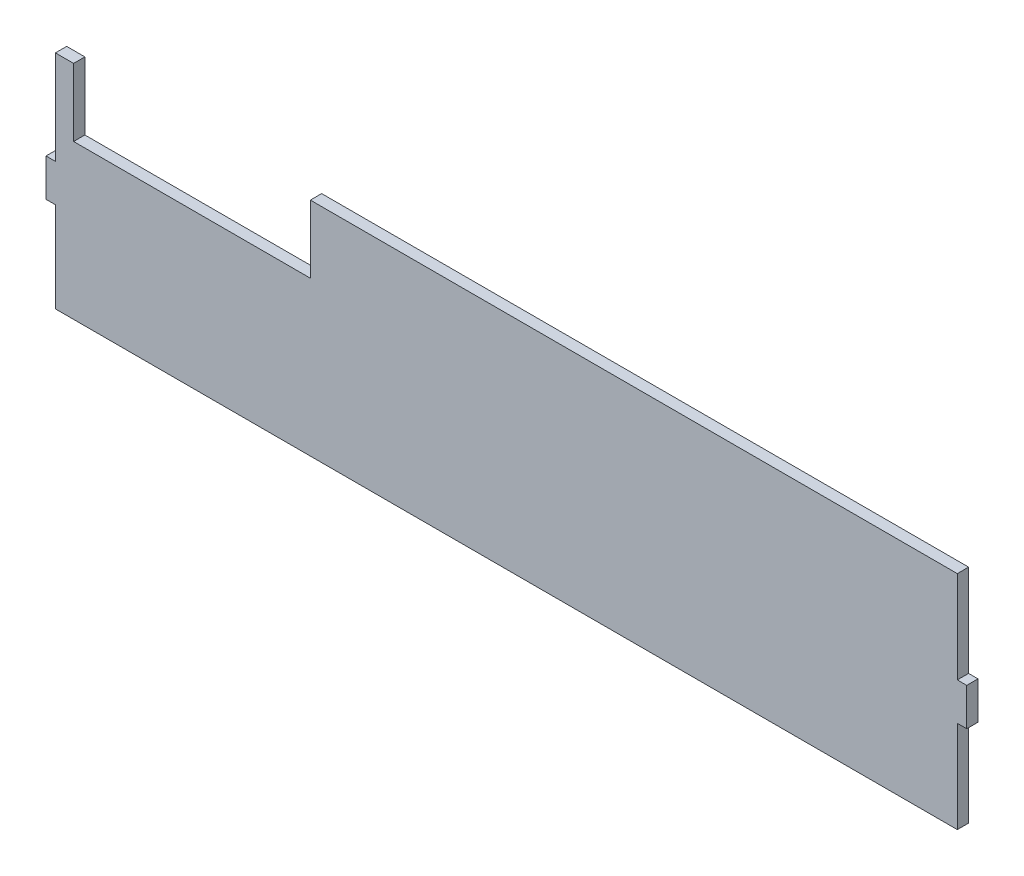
SolidWorks part; units mm, degrees
ref_plane "Front Plane" through (0, 0, 0) normal (0, 0, 1) x (1, 0, 0)
ref_plane "Top Plane" through (0, 0, 0) normal (0, 1, 0) x (1, 0, 0)
ref_plane "Right Plane" through (0, 0, 0) normal (1, 0, 0) x (0, 0, -1)
sketch "Sketch1" plane through (0, 0, 0) normal (0, 0, 1) x (1, 0, 0)
  line L0 (-110.2336, 12.7) -> (-110.2336, 44.45)
  line L1 (-110.2336, 44.45) -> (194.5664, 44.45)
  line L2 (-110.2336, 0) -> (-110.2336, -30.48)
  line L3 (-110.2336, -30.48) -> (194.5664, -30.48)
  line L4 (194.5664, 13.335) -> (194.5664, 44.45)
  line L5 (-113.4086, 12.7) -> (-110.2336, 12.7)
  line L6 (-113.4086, 12.7) -> (-113.4086, 0)
  line L7 (-113.4086, 0) -> (-110.2336, 0)
  line L9 (194.5664, 13.335) -> (197.7414, 13.335)
  line L11 (194.5664, 0.635) -> (197.7414, 0.635)
  line L12 (197.7414, 13.335) -> (197.7414, 0.635)
  line L13 (194.5664, 0.635) -> (194.5664, -30.48)
  dimension "D3" = 31.115
  dimension "D4" = 12.7
  dimension "D5" = 31.75
  dimension "D6" = 12.7
  dimension "D7" = 31.115
  dimension "D8" = 304.8
  dimension "D9" = 3.175
  dimension "D10" = 3.175
  dimension "D11" = 304.8
extrude "Extrude1" add sketch "Sketch1" along normal blind 3.81
sketch "Sketch2" plane through (0, 0, 3.81) normal (0, 0, 1) x (1, 0, 0)
  line L0 (194.5664, 44.45) -> (-110.2336, 44.45) construction
  line L1 (-104.08, 44.45) -> (-24.07, 44.45)
  line L2 (-104.08, 44.45) -> (-104.08, 21.59)
  line L3 (-104.08, 21.59) -> (-24.07, 21.59)
  line L4 (-24.07, 44.45) -> (-24.07, 21.59)
  dimension "D1" = 80.01
  dimension "D2" = 22.86
extrude "Cut-Extrude1" cut sketch "Sketch2" against normal through all
